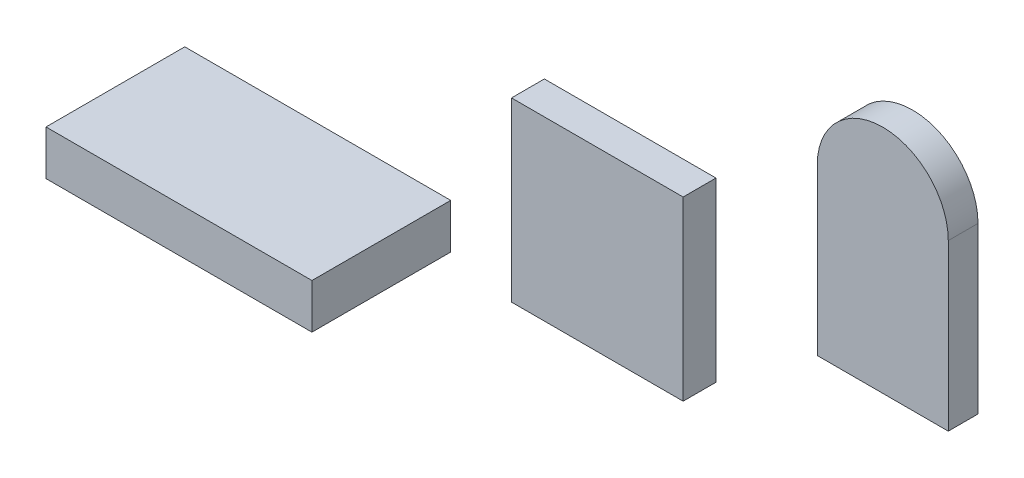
SolidWorks part; units mm, degrees
ref_plane "Front Plane" through (0, 0, 0) normal (0, 0, 1) x (1, 0, 0)
ref_plane "Top Plane" through (0, 0, 0) normal (0, 1, 0) x (1, 0, 0)
ref_plane "Right Plane" through (0, 0, 0) normal (1, 0, 0) x (0, 0, -1)
sketch "Sketch1" plane through (0, 0, 0) normal (0, 0, 1) x (1, 0, 0)
  line L1 (-19.1686, -19.7539) -> (19.1686, -19.7539)
  line L2 (-19.1686, -19.7539) -> (-19.1686, 19.7539)
  line L3 (-19.1686, 19.7539) -> (19.1686, 19.7539)
  line L4 (19.1686, -19.7539) -> (19.1686, 19.7539)
  line L5 (-19.1686, -19.7539) -> (19.1686, 19.7539) construction
  line L6 (-19.1686, 19.7539) -> (19.1686, -19.7539) construction
  point P0 (0, 0)
sketch "Sketch2" plane through (0, 0, 0) normal (0, 0, 1) x (1, 0, 0)
  line L2 (48.4336, 40.2394) -> (48.4336, 3.3655)
  line L3 (48.4336, 3.3655) -> (77.6986, 3.3655)
  line L4 (77.6986, 40.2394) -> (77.6986, 3.3655)
  arc A1 (77.6986, 40.2394) -> (48.4336, 40.2394) centre (63.0661, 40.2394) ccw
  point P0 (63.0661, 21.8024)
sketch "Sketch4" plane through (0, -8.9737, 0) normal (0, 0, 1) x (1, 0, 0)
  line L0 (-99.4934, -5.2199) -> (-40.0855, -5.2199)
extrude "Extrude-Thin1" add sketch "Sketch4" along normal blind 31 thin contours L0
extrude "Boss-Extrude3" add sketch "Sketch1" along normal blind 7.3374 separate body contours L1 L4 L3 L2
extrude "Boss-Extrude4" add sketch "Sketch2" along normal blind 6.6386 separate body contours L3 L4 A1 L2
ref_plane "Plane5" through (0, -7.0968, 7.0968) normal (0, 0.7071, -0.7071) x (1, 0, 0)
ref_plane "Plane6" through (0.6773, 0, 3.539) normal (0.188, 0, 0.9822) x (0.9822, 0, -0.188)
